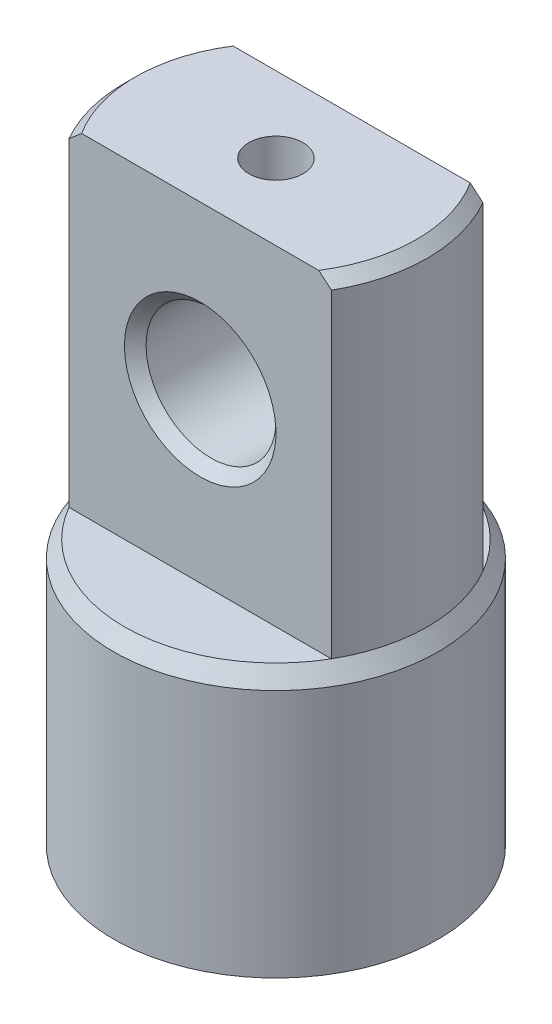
SolidWorks part; units mm, degrees
ref_plane "Front Plane" through (0, 0, 0) normal (0, 0, 1) x (1, 0, 0)
ref_plane "Top Plane" through (0, 0, 0) normal (0, 1, 0) x (1, 0, 0)
ref_plane "Right Plane" through (0, 0, 0) normal (1, 0, 0) x (0, 0, -1)
sketch "Sketch1" plane through (0, 0, 0) normal (0, 0, 1) x (1, 0, 0)
  line L0 (0, 0) -> (15, 0)
  line L1 (15, 0) -> (15, 23)
  line L4 (14, 24.5) -> (14, 55)
  line L5 (14, 55) -> (0, 55)
  line L6 (0, 0) -> (0, 55) construction
  line L7 (0, 0) -> (0, 55)
  line L8 (14, 24.5) -> (15, 23)
  dimension "D1" = 30
  dimension "D2" = 30.5
  dimension "D3" = 28
  dimension "D4" = 23
  dimension "D8" = 55
revolve "Revolve1" add sketch "Sketch1" angle 360 about L6
sketch "Sketch2" plane through (0, 55, 0) normal (0, 1, 0) x (1, 0, 0)
  line L1 (5.7735, 0) -> (2.8868, 5)
  line L2 (2.8868, 5) -> (-2.8868, 5)
  line L3 (-2.8868, 5) -> (-5.7735, 0)
  line L4 (-5.7735, 0) -> (-2.8868, -5)
  line L5 (-2.8868, -5) -> (2.8868, -5)
  line L6 (2.8868, -5) -> (5.7735, 0)
  circle A0 centre (0, 0) radius 5 construction
  dimension "D1" = 10
extrude "Cut-Extrude2" [suppressed] cut sketch "Sketch2" against normal blind 8
sketch "Sketch3" plane through (0, 55, 0) normal (0, 1, 0) x (-1, 0, 0)
  line L1 (13.2665, -7) -> (-13.2665, -7)
  line L3 (13.2665, 7) -> (-13.2665, 7)
  circle A0 centre (0, 0) radius 15 construction
  arc A1 (13.2665, 7) -> (-13.2665, 7) centre (0, 0) ccw
  arc A2 (-13.2665, -7) -> (13.2665, -7) centre (0, 0) ccw
  dimension "D1" = 7
  dimension "D2" = 14
extrude "Cut-Extrude3" cut sketch "Sketch3" against normal blind 30.5
chamfer "Chamfer1" distance 1 angle 45 2 edges at (14, 55, 0) (-14, 55, 0)
hole_wizard "Ø12.0 (12) Diameter Hole1" positions "Sketch5" profile "Sketch4" hole size "Ø12.0" standard "ISO"
sketch "Sketch5" plane through (0, 0, 7) normal (0, 0, 1) x (1, 0, 0)
  line L0 (10.9545, 55) -> (-10.9545, 55) construction
  point P0 (0, 40)
  dimension "D1" = 15
sketch "Sketch4" plane through (0, 40, 7) normal (1, 0, 0) x (0, -1, 0)
  line L0 (0, 0) -> (0, 14)
  line L1 (0, 14) -> (6, 14)
  line L2 (6, 14) -> (6, 0)
  line L5 (6, 0) -> (0, 0)
  line L11 (0, -6.35) -> (0, 107.95) construction
  dimension "Thru Hole Dia." = 12
  dimension "Thru Hole Depth" = 14
chamfer "Chamfer2" distance 1 angle 45 2 edges at (6, 40, -7) (6, 40, 7)
hole_wizard "M6 Tapped Hole1" positions "Sketch7" profile "Sketch6" tap size "M6" standard "ISO"
sketch "Sketch7" plane through (0, 55, 0) normal (0, 1, 0) x (-1, 0, 0)
  point P0 (0, 0)
sketch "Sketch6" plane through (0, 55, 0) normal (1, 0, 0) x (0, 0, 1)
  line L0 (0, 0) -> (0, 9)
  line L1 (0, 9) -> (2.5, 9)
  line L2 (2.5, 9) -> (2.5, 0)
  line L5 (2.5, 0) -> (0, 0)
  line L11 (0, -6.35) -> (0, 107.95) construction
  dimension "Thru Tap Drill Dia." = 5
  dimension "Thru Tap Drill Depth" = 9
